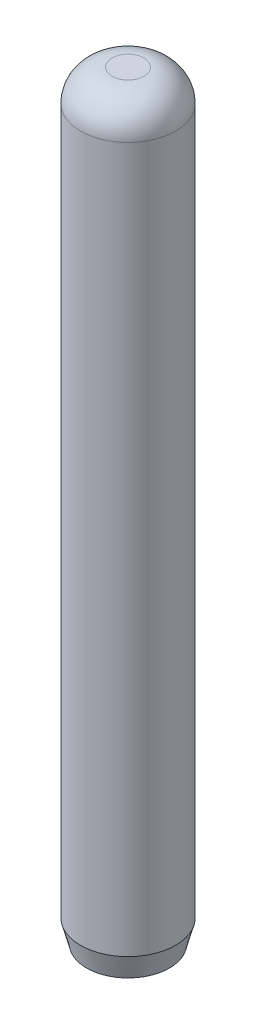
SolidWorks part; units mm, degrees
ref_plane "Front x-y" through (0, 0, 0) normal (0, 0, 1) x (1, 0, 0)
ref_plane "Top x-z" through (0, 0, 0) normal (0, 1, 0) x (1, 0, 0)
ref_plane "Side y-z" through (0, 0, 0) normal (1, 0, 0) x (0, 0, -1)
sketch "Sketch1" plane through (0, 0, 0) normal (0, 0, 1) x (1, 0, 0)
  line L0 (1.1919, 0) -> (1.1919, 19.05) construction
  line L1 (1.1919, 0) -> (1.1919, 19.05)
  line L2 (1.1919, 19.05) -> (1.59, 19.05)
  line L3 (2.3838, 18.2563) -> (2.3838, 0.5721)
  line L4 (2.3838, 0.5721) -> (2.2305, 0)
  line L5 (2.2305, 0) -> (1.1919, 0)
  arc A0 (2.3838, 18.2563) -> (1.59, 19.05) centre (1.59, 18.2563) ccw
  dimension "D4" = 1.1919
  dimension "D1" = 0.7937
  dimension "D2" = 19.05
  dimension "D3" = 0.1533
  dimension "D5" = 15
revolve "Base-Revolve" add sketch "Sketch1" angle 360 about L0
